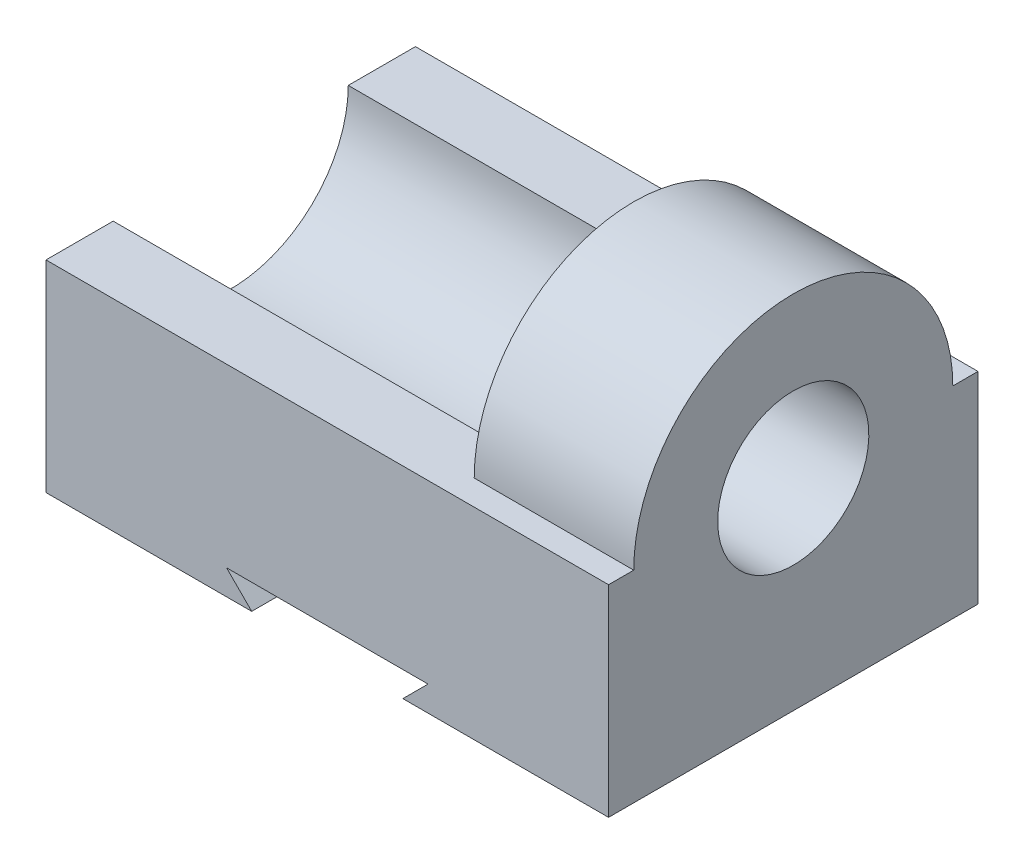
SolidWorks part; units mm, degrees
ref_plane "前视基准面" through (0, 0, 0) normal (0, 0, 1) x (1, 0, 0)
ref_plane "上视基准面" through (0, 0, 0) normal (0, 1, 0) x (1, 0, 0)
ref_plane "右视基准面" through (0, 0, 0) normal (1, 0, 0) x (0, 0, -1)
sketch "草图1" plane through (0, 0, 0) normal (0, 0, 1) x (1, 0, 0)
  line L0 (0, 0) -> (24.5, 0)
  line L1 (67, 0) -> (67, 24)
  line L2 (67, 24) -> (0, 24)
  line L3 (0, 24) -> (0, 0)
  line L4 (33.5, 0) -> (33.5, 58.247) construction
  line L5 (24.5, 0) -> (21.5, 3)
  line L6 (21.5, 3) -> (45.5, 3)
  line L7 (45.5, 3) -> (42.5, 0)
  line L8 (42.5, 0) -> (67, 0)
  dimension "D1" = 67
  dimension "D2" = 24
  dimension "D3" = 9
  dimension "D4" = 18
  dimension "D5" = 12
  dimension "D6" = 12
  dimension "D7" = 3
extrude "拉伸1" add sketch "草图1" along normal mid plane 44
sketch "草图2" plane through (67, 0, 0) normal (1, 0, 0) x (0, 0, -1)
  line L0 (-22, 24) -> (22, 24) construction
  line L1 (19, 24) -> (-19, 24)
  arc A0 (-19, 24) -> (19, 24) centre (0, 24) cw
extrude "拉伸2" add sketch "草图2" against normal blind 19
sketch "草图3" plane through (67, 0, 0) normal (1, 0, 0) x (0, 0, -1)
  circle A0 centre (0, 24) radius 9
extrude "切除-拉伸1" cut sketch "草图3" against normal blind 19
sketch "草图4" plane through (0, 0, 0) normal (-1, 0, 0) x (0, 0, 1)
  line L0 (22, 24) -> (-22, 24) construction
  circle A0 centre (0, 24) radius 14
extrude "切除-拉伸2" cut sketch "草图4" against normal up to surface (48 mm away)
